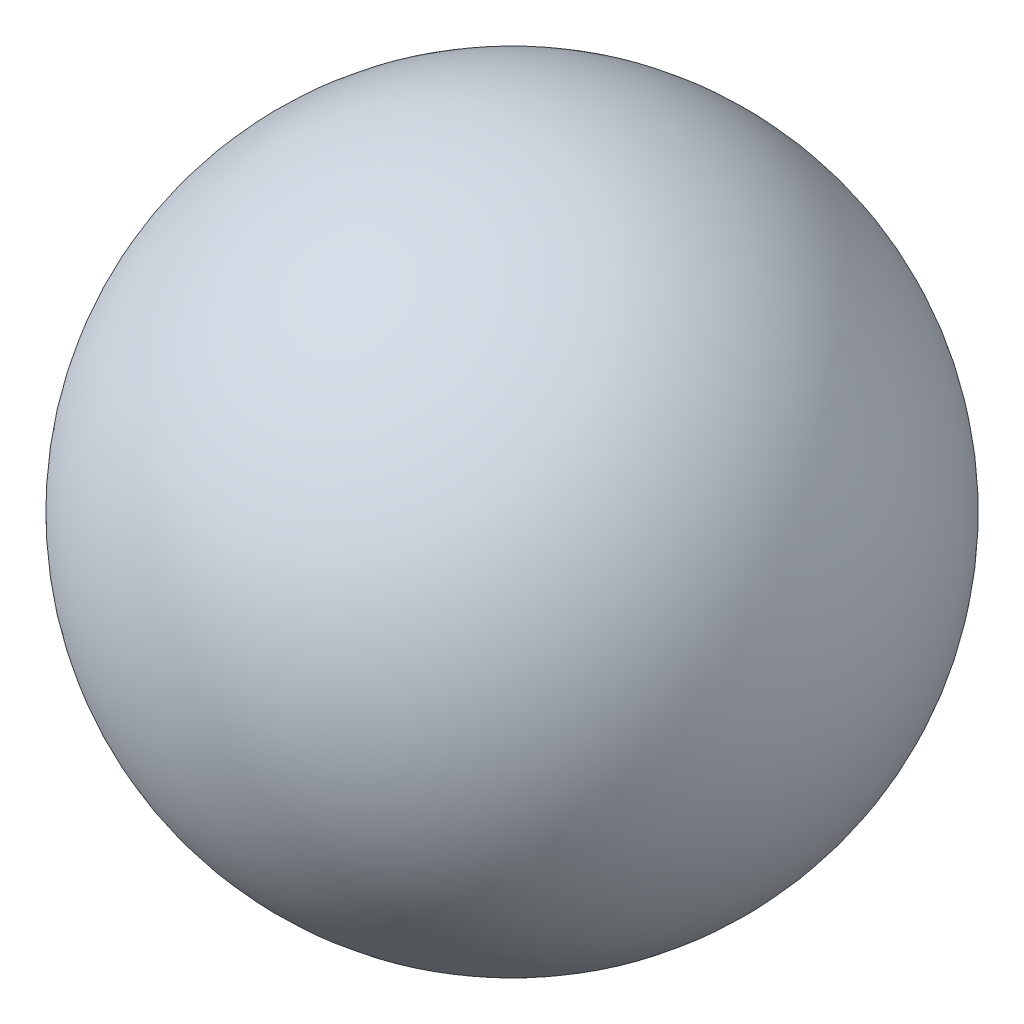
SolidWorks part; units mm, degrees
ref_plane "Přední rovina" through (0, 0, 0) normal (0, 0, 1) x (1, 0, 0)
ref_plane "Horní rovina" through (0, 0, 0) normal (0, 1, 0) x (1, 0, 0)
ref_plane "Pravá rovina" through (0, 0, 0) normal (1, 0, 0) x (0, 0, -1)
sketch "Skica1" plane through (0, 0, 0) normal (0, 0, 1) x (1, 0, 0)
  line L0 (0, 3.969) -> (0, -3.969) construction
  line L1 (0, 0) -> (3.969, 0) construction
  line L2 (0, 3.969) -> (0, -3.969)
  arc A0 (0, -3.969) -> (0, 3.969) centre (0, 0) ccw
revolve "Rotovat3" add sketch "Skica1" angle 360 about L2
